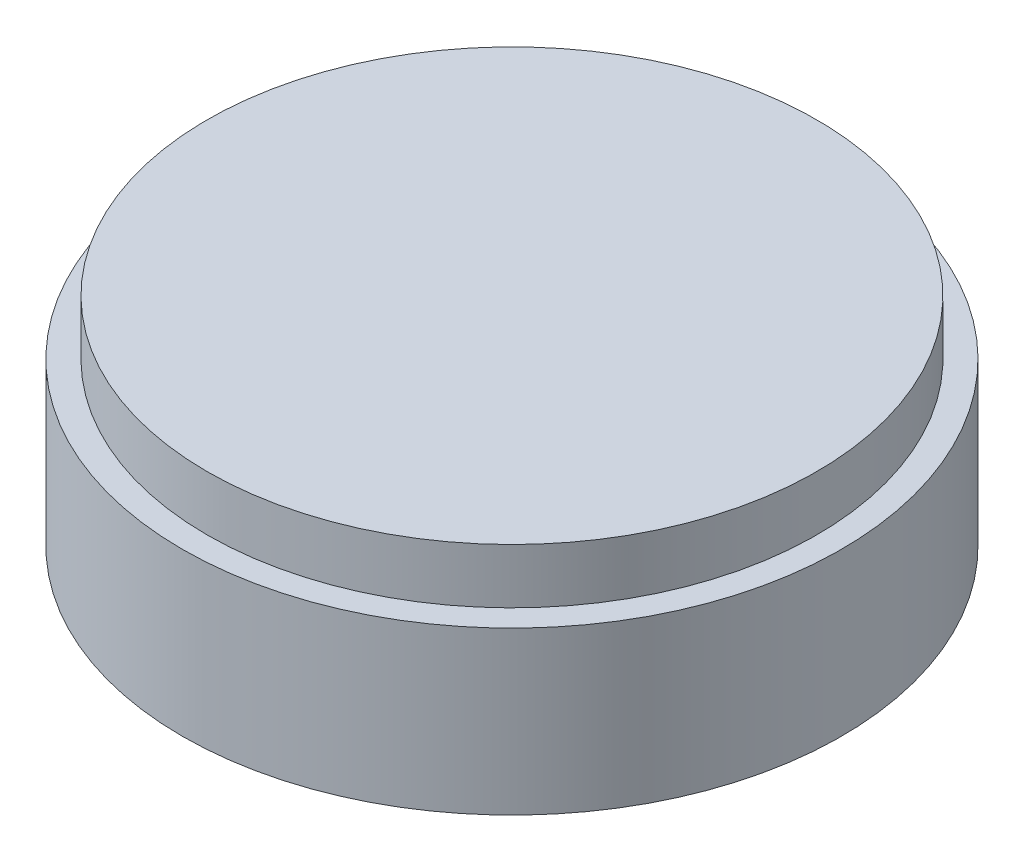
SolidWorks part; units mm, degrees
ref_plane "Ön Düzlem" through (0, 0, 0) normal (0, 0, 1) x (1, 0, 0)
ref_plane "Üst Düzlem" through (0, 0, 0) normal (0, 1, 0) x (1, 0, 0)
ref_plane "Sağ Düzlem" through (0, 0, 0) normal (1, 0, 0) x (0, 0, -1)
sketch "Çizim1" plane through (0, 0, 0) normal (0, 1, 0) x (1, 0, 0)
  circle A0 centre (0, 0) radius 37.85
  dimension "D1" = 75.7
extrude "Yükseklik-Ekstrüzyon1" add sketch "Çizim1" along normal blind 18.6
sketch "Çizim2" plane through (0, 18.6, 0) normal (0, 1, 0) x (1, 0, 0)
  circle A0 centre (0, 0) radius 35
  dimension "D1" = 70
extrude "Yükseklik-Ekstrüzyon2" add sketch "Çizim2" along normal blind 6.3
sketch "Çizim3" plane through (0, 0, 0) normal (0, -1, 0) x (1, 0, 0)
  line L0 (0, -29.5) -> (0, 29.5) construction
  line L1 (-20.8597, -20.8597) -> (20.8597, 20.8597) construction
  line L2 (20.8597, -20.8597) -> (-20.8597, 20.8597) construction
  line L3 (-37.85, 0) -> (37.85, 0) construction
  line L4 (0, 37.85) -> (0, -37.85) construction
  circle A0 centre (0, 0) radius 29.5 construction
  circle A1 centre (-20.8597, 20.8597) radius 1.5
  circle A2 centre (20.8597, 20.8597) radius 1.5
  circle A3 centre (20.8597, -20.8597) radius 1.5
  circle A4 centre (-20.8597, -20.8597) radius 1.5
  circle A5 centre (0, 0) radius 37.85 construction
  circle A6 centre (0, 29.5) radius 1.5
  point P19 (0, 0)
  dimension "D1" = 59
  dimension "D3" = 3
  dimension "D5" = 3
  dimension "D2" = 45
  dimension "D4" = 4
extrude "Kes-Ekstrüzyon1" cut sketch "Çizim3" against normal blind 6.3
